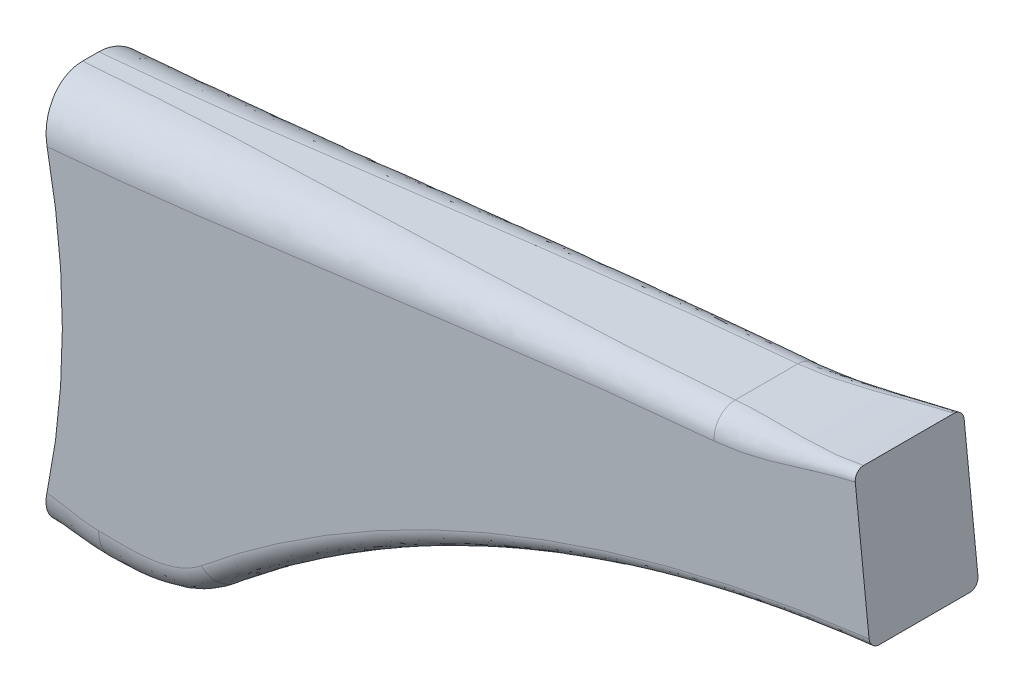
SolidWorks part; units mm, degrees
ref_plane "Front Plane" through (0, 0, 0) normal (0, 0, 1) x (1, 0, 0)
ref_plane "Top Plane" through (0, 0, 0) normal (0, 1, 0) x (1, 0, 0)
ref_plane "Right Plane" through (0, 0, 0) normal (1, 0, 0) x (0, 0, -1)
sketch "Sketch1" plane through (0, 0, 0) normal (0, 0, 1) x (1, 0, 0)
  line L4 (185.3415, 122.5869) -> (0.0634, 107.1869)
  line L5 (0, 0) -> (17.1738, 0)
  line L6 (228.6, 88.011) -> (224.282, 128.3937)
  arc A4 (228.6, 88.011) -> (49.4165, 11.5438) centre (269.867, -256.8604) ccw
  arc A5 (17.1738, 0) -> (49.4165, 11.5438) centre (17.1738, 50.8) ccw
  arc A6 (0.0634, 107.1869) -> (0, 0) centre (-195.9733, 53.7094) cw
  arc A7 (224.282, 128.3937) -> (185.3415, 122.5869) centre (160.2767, 424.1441) cw
extrude "Boss-Extrude1" add sketch "Sketch1" along normal mid plane 29.845
fillet "VarFillet1" radius 6.35 4 edges at (204.9063, 124.8563, -14.9225) (92.7025, 114.8869, -14.9225) (92.7025, 114.8869, 14.9225) (204.9063, 124.8563, 14.9225)
fillet "VarFillet2" radius 2.54 6 edges at (34.2972, 2.9729, 14.9225) (8.5869, 0, 14.9225) (8.5869, 0, -14.9225) (34.2972, 2.9729, -14.9225) (133.5372, 62.5976, -14.9225) (133.5372, 62.5976, 14.9225)
